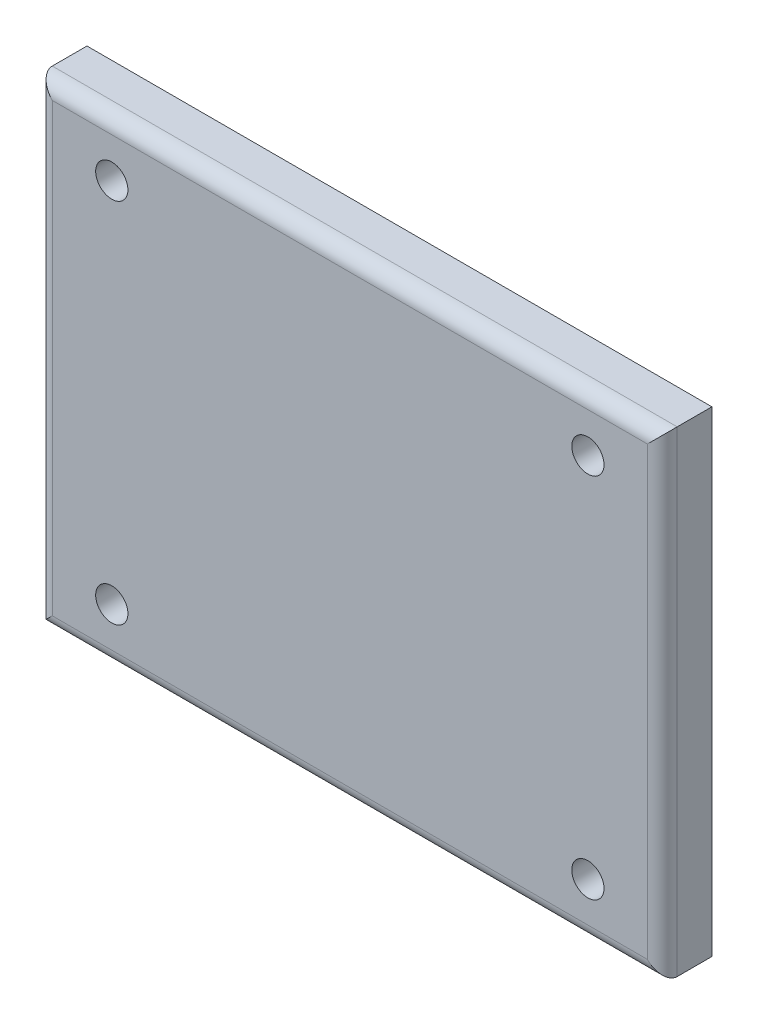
SolidWorks part; units mm, degrees
ref_plane "Face" through (0, 0, 0) normal (0, 0, 1) x (1, 0, 0)
ref_plane "Dessus" through (0, 0, 0) normal (0, 1, 0) x (1, 0, 0)
ref_plane "Droite" through (0, 0, 0) normal (1, 0, 0) x (0, 0, -1)
sketch "Esquisse1" plane through (0, 0, 0) normal (0, 0, 1) x (1, 0, 0)
  line L1 (-26.9383, 53.5151) -> (99.0617, 53.5151)
  line L2 (-26.9383, 53.5151) -> (-26.9383, -42.4849)
  line L3 (-26.9383, -42.4849) -> (99.0617, -42.4849)
  line L4 (99.0617, 53.5151) -> (99.0617, -42.4849)
  dimension "D1" = 96
  dimension "D2" = 126
extrude "Extrusion1" add sketch "Esquisse1" along normal blind 10
fillet "Congé1" radius 3 4 edges at (99.0617, 5.5151, 10) (36.0617, -42.4849, 10) (-26.9383, 5.5151, 10) (36.0617, 53.5151, 10)
sketch "Esquisse2" plane through (0, 0, 10) normal (0, 0, 1) x (1, 0, 0)
  line L0 (36.0617, 50.5151) -> (36.0617, -36.1904) construction
  line L1 (96.0617, 50.5151) -> (-23.9383, 50.5151) construction
  line L2 (96.0617, 5.5151) -> (-8.1511, 5.5151) construction
  line L3 (96.0617, -39.4849) -> (96.0617, 50.5151) construction
sketch "Esquisse3" plane through (0, 0, 10) normal (0, 0, 1) x (1, 0, 0)
  line L0 (96.0617, 5.5151) -> (-8.1511, 5.5151) construction
  line L1 (36.0617, 50.5151) -> (36.0617, -36.1904) construction
  circle A0 centre (-11.9383, 42.5151) radius 3.25
  dimension "D1" = 6.5
  dimension "D2" = 37
  dimension "D3" = 48
extrude "Enlèv. mat.-Extru.1" cut sketch "Esquisse3" against normal through all
pattern_linear "Répétition linéaire1" count 2 spacing 96 along (1, 0, 0) count 2 spacing 74 along (0, -1, 0) of "Enlèv. mat.-Extru.1"
